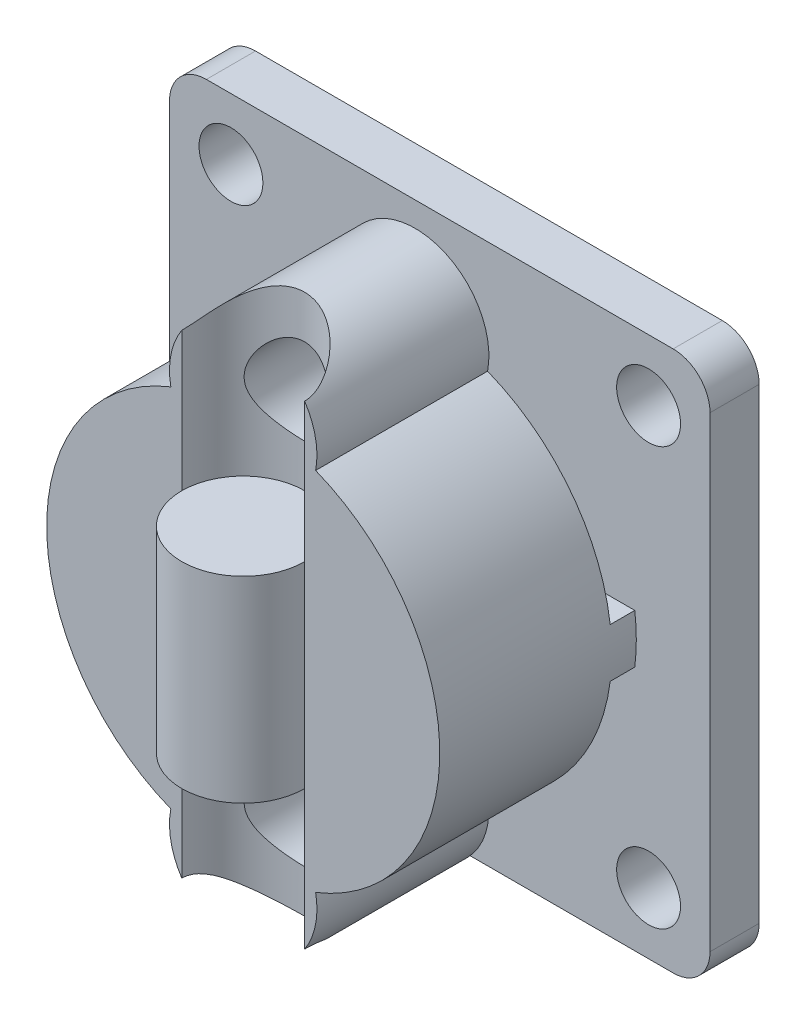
SolidWorks part; units mm, degrees
ref_plane "Plan de face" through (0, 0, 0) normal (0, 0, 1) x (1, 0, 0)
ref_plane "Plan de dessus" through (0, 0, 0) normal (0, 1, 0) x (1, 0, 0)
ref_plane "Plan de droite" through (0, 0, 0) normal (1, 0, 0) x (0, 0, -1)
sketch "Esquisse1" plane through (0, 0, 0) normal (0, 0, 1) x (1, 0, 0)
  line L1 (-22, 22) -> (0, 22)
  line L2 (-22, 22) -> (-22, 0)
  line L3 (-22, 0) -> (0, 0)
  line L4 (0, 22) -> (0, 0)
  dimension "D1" = 22
  dimension "D2" = 22
extrude "Extrusion1" add sketch "Esquisse1" along normal blind 2
sketch "Esquisse2" plane through (0, 0, 2) normal (0, 0, 1) x (1, 0, 0)
  line L0 (-22, 22) -> (-22, 0) construction
  line L1 (0, 22) -> (-22, 22) construction
  line L2 (-22, 0) -> (0, 0) construction
  arc A0 (-13.9468, 18.4375) -> (-13.9468, 3.5625) centre (-11, 11) ccw
  arc A1 (-8.0532, 18.4375) -> (-13.9468, 18.4375) centre (-11, 19) ccw
  arc A2 (-13.9468, 3.5625) -> (-8.0532, 3.5625) centre (-11, 3) ccw
  arc A3 (-8.0532, 3.5625) -> (-8.0532, 18.4375) centre (-11, 11) ccw
  point P4 (-11, 22)
  dimension "D3" = 16
  dimension "D4" = 6
  dimension "D5" = 6
  dimension "D6" = 11
  dimension "D1" = 11
  dimension "D2" = 11
  dimension "D7" = 11
extrude "Extrusion2" add sketch "Esquisse2" along normal blind 8
sketch "Esquisse3" plane through (0, 22, 0) normal (0, 1, 0) x (-1, 0, 0)
  line L0 (19, 10) -> (13.9468, 10) construction
  line L1 (0, 2) -> (0, 0) construction
  circle A0 centre (11, 10) radius 2.5
  dimension "D2" = 5
  dimension "D1" = 11
extrude "Enlèv. mat.-Extru.1" cut sketch "Esquisse3" against normal through all
ref_plane "Plan1" through (0, 11, 0) normal (0, 1, 0) x (-1, 0, 0)
hole_wizard "Dégagement M21" positions "Esquisse6" profile "Esquisse5" hole size "M2" standard "ISO"
sketch "Esquisse6" plane through (0, 0, 2) normal (0, 0, 1) x (1, 0, 0)
  line L0 (0, 0) -> (0, 22) construction
  line L1 (0, 22) -> (-11, 22) construction
  point P0 (-2.5, 19.5)
  dimension "D1" = 2.5
  dimension "D2" = 2.5
sketch "Esquisse5" plane through (-2.5, 19.5, 2) normal (1, 0, 0) x (0, -1, 0)
  line L0 (0, 0) -> (0, 2)
  line L1 (0, 2) -> (1.3, 2)
  line L2 (1.3, 2) -> (1.3, 0)
  line L5 (1.3, 0) -> (0, 0)
  line L11 (0, -6.35) -> (0, 107.95) construction
  dimension "Diamètre du perçage jusqu'au prochain" = 2.6
  dimension "Profondeur du perçage jusqu'au prochain" = 2
pattern_linear "Répétition linéaire1" count 2 spacing 17 along (0, -1, 0) count 2 spacing 17 along (-1, 0, 0) of "Dégagement M21"
fillet "Congé1" radius 1.5 4 edges at (-22, 22, 1) (0, 22, 1) (0, 0, 1) (-22, 0, 1)
sketch "Esquisse8" plane through (0, 0, 0) normal (0, 0, -1) x (-1, 0, 0)
  circle A0 centre (11, 11) radius 9
  circle A1 centre (11, 11) radius 6
  arc A2 (8.0532, 18.4375) -> (8.0532, 3.5625) centre (11, 11) ccw construction
  dimension "D1" = 18
  dimension "D2" = 12
extrude "Extrusion4" add sketch "Esquisse8" along normal blind 2
fillet "Congé2" radius 0.2 2 edges at (-20, 11, -2) (-17, 11, -2)
sketch "Esquisse11" plane through (-22, 0, 0) normal (-1, 0, 0) x (0, 0, 1)
  line L0 (2, 20.5) -> (2, 1.5) construction
  line L1 (2, 12) -> (3, 12)
  line L2 (2, 12) -> (2, 22.9899)
  line L3 (2, 22.9899) -> (3, 22.9899)
  line L4 (3, 12) -> (3, 22.9899)
  line L5 (1.1, 11) -> (-1.1, 11) construction
  line L6 (2, 10) -> (3, 10)
  line L7 (2, 10) -> (2, -3.0467)
  line L8 (2, -3.0467) -> (3, -3.0467)
  line L9 (3, 10) -> (3, -3.0467)
  dimension "D1" = 1
  dimension "D2" = 1
  dimension "D3" = 1
  dimension "D4" = 1
extrude "Enlèv. mat.-Extru.3" cut sketch "Esquisse11" against normal through all
sketch "Esquisse7" plane through (0, 0, 10) normal (0, 0, 1) x (1, 0, 0)
  circle A0 centre (-11, 18.5) radius 1.75
  circle A2 centre (-11, 11) radius 6 construction
  dimension "D1" = 3.5
  dimension "D2" = 7.5
extrude "Enlèv. mat.-Extru.2" cut sketch "Esquisse7" against normal blind 5
hole_wizard "Trou taraudé M2x0.41" positions "Esquisse10" profile "Esquisse9" tap size "M2x0.4" standard "ISO"
sketch "Esquisse10" plane through (0, 0, 5) normal (0, 0, 1) x (1, 0, 0)
  circle A0 centre (-11, 18.5) radius 1.75 construction
  point P0 (-11, 18.5)
sketch "Esquisse9" plane through (-11, 18.5, 5) normal (1, 0, 0) x (0, -1, 0)
  line L0 (0, 0) -> (0, 7)
  line L1 (0, 7) -> (0.8, 7)
  line L2 (0.8, 7) -> (0.8, 0)
  line L5 (0.8, 0) -> (0, 0)
  line L11 (0, -6.35) -> (0, 107.95) construction
  dimension "Diamètre du trou pour taraudage jusqu'au prochain" = 1.6
  dimension "Profondeur du trou pour taraudage jusqu'au prochain" = 7
sketch "Esquisse13" plane through (0, 0, 5) normal (0, 0, 1) x (1, 0, 0)
  circle A0 centre (-11, 18.5) radius 0.9
  circle A1 centre (-11, 18.5) radius 1.75 construction
  dimension "D1" = 1.8
extrude "Enlèv. mat.-Extru.5" cut sketch "Esquisse13" against normal up to next
pattern_linear "Répétition linéaire2" count 2 spacing 15 along (0, -1, 0) of "Enlèv. mat.-Extru.2", "Trou taraudé M2x0.41", "Enlèv. mat.-Extru.5"
sketch "Esquisse12" plane through (0, 0, 0) normal (0, 0, -1) x (-1, 0, 0)
  circle A0 centre (11, 11) radius 2
  circle A1 centre (11, 11) radius 9 construction
  dimension "D1" = 4
extrude "Enlèv. mat.-Extru.4" cut sketch "Esquisse12" against normal through all
sketch "Esquisse4" plane through (0, 11, 0) normal (0, 1, 0) x (-1, 0, 0)
  circle A0 centre (11, 10) radius 2.5
  arc A1 (8.5, 10) -> (13.5, 10) centre (11, 10) ccw construction
extrude "Extrusion3" add sketch "Esquisse4" along normal mid plane 8
